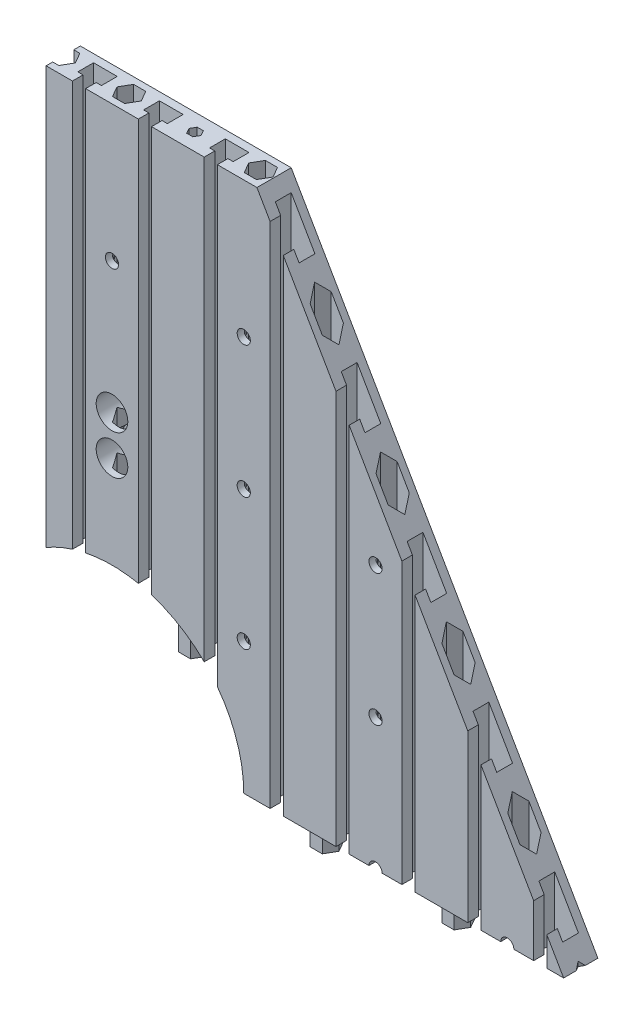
SolidWorks part; units mm, degrees
ref_plane "Plan de face" through (0, 0, 0) normal (0, 0, 1) x (1, 0, 0)
ref_plane "Plan de dessus" through (0, 0, 0) normal (0, 1, 0) x (1, 0, 0)
ref_plane "Plan de droite" through (0, 0, 0) normal (1, 0, 0) x (0, 0, -1)
sketch "Esquisse1" plane through (0, 0, 0) normal (0, 0, 1) x (1, 0, 0)
  line L6 (35.7636, 358.7862) -> (-423.8647, -437.3133) construction
  line L7 (-755.4678, -148.4209) -> (879.7592, -148.4209) construction
  line L8 (-46.1325, 376.7457) -> (415.4529, -422.7436) construction
  line L9 (257.0726, -148.4209) -> (-245.0999, 141.5085) construction
  line L10 (-257.0726, -148.4209) -> (263.2247, 151.9729) construction
  line L11 (-55, 201.5791) -> (55, 201.5791)
  line L12 (-147.0726, -148.4209) -> (147.0726, -148.4209)
  line L13 (147.0726, -148.4209) -> (202.0726, -53.1581)
  line L14 (202.0726, -53.1581) -> (55, 201.5791)
  line L15 (-147.0726, -148.4209) -> (-202.0726, -53.1581)
  line L16 (-202.0726, -53.1581) -> (-55, 201.5791)
  dimension "D1" = 60
  dimension "D2" = 60
  dimension "D3" = 110
  dimension "D4" = 350
  dimension "D5" = 60
  dimension "D6" = 60
  dimension "D7" = 110
  dimension "D8" = 110
extrude "Boss.-Extru.2" add sketch "Esquisse1" along normal blind 13
sketch "Esquisse3" plane through (0, 201.5791, 0) normal (0, 1, 0) x (1, 0, 0)
  line L0 (-12.5, 6.793) -> (-12.5, -19.2478) construction
  line L1 (-8, -3) -> (-17, -3)
  line L2 (-17, -3) -> (-17, -9)
  line L3 (-17, -9) -> (-15, -9)
  line L4 (-15, -9) -> (-15, -13)
  line L5 (55, -13) -> (-55, -13) construction
  line L6 (-10, -9) -> (-10, -13)
  line L7 (-8, -9) -> (-10, -9)
  line L8 (-8, -3) -> (-8, -9)
  line L9 (-15, -13) -> (-10, -13)
  point P2 (-12.5, -13)
  point P14 (-12.5, -3)
  dimension "D1" = 12.5
  dimension "D2" = 9
  dimension "D3" = 5
  dimension "D4" = 6
  dimension "D5" = 4
extrude "Enlèv. mat.-Extru.1" cut sketch "Esquisse3" against normal up to next
pattern_linear "Répétition linéaire1" count 8 spacing 25 along (1, 0, 0) of "Enlèv. mat.-Extru.1"
pattern_linear "Répétition linéaire2" count 7 spacing 25 along (-1, 0, 0) of "Enlèv. mat.-Extru.1"
sketch "certcleRotules" plane through (0, 0, 13) normal (0, 0, 1) x (1, 0, 0)
  circle A0 centre (0, 0) radius 157.5
  dimension "D1" = 315
sketch "Esquisse6" plane through (0, 0, 0) normal (0, 1, 0) x (1, 0, 0)
  line L0 (-157.5, -13) -> (157.5, -13) construction
  line L1 (0, 0) -> (-4.5, 0)
  line L2 (0, 0) -> (0, -13)
  line L3 (-2.5, -9) -> (-4.5, -9)
  line L4 (-4.5, 0) -> (-4.5, -9)
  line L7 (0, -13) -> (-2.5, -13)
  line L8 (-2.5, -9) -> (-2.5, -13)
  dimension "D1" = 4.5
  dimension "D2" = 2.5
  dimension "D3" = 4
revolve "Enlèvement de matière-Révolution1" cut sketch "Esquisse6" angle 360 about L2
pattern_linear "Répétition linéaire3" count 4 spacing 50 along (0, 1, 0) count 4 spacing 50 along (1, 0, 0) of "Enlèvement de matière-Révolution1"
pattern_linear "Répétition linéaire5" count 3 spacing 50 along (0, -1, 0) count 4 spacing 50 along (1, 0, 0) of "Enlèvement de matière-Révolution1"
pattern_linear "Répétition linéaire6" count 4 spacing 50 along (0, 1, 0) count 4 spacing 50 along (-1, 0, 0) of "Enlèvement de matière-Révolution1"
pattern_linear "Répétition linéaire7" count 3 spacing 50 along (0, -1, 0) count 4 spacing 50 along (-1, 0, 0) of "Enlèvement de matière-Révolution1"
sketch "Esquisse8" plane through (0, 0, 0) normal (0, 0, -1) x (-1, 0, 0)
  circle A0 centre (0, 100) radius 4.5 construction
  circle A1 centre (0, 100) radius 4.5
extrude "bouchonBarreauHaut" add sketch "Esquisse8" against normal blind 13
sketch "Esquisse7" plane through (0, 0, 0) normal (0, 0, -1) x (-1, 0, 0)
  line L1 (-6.5, 105.15) -> (6.5, 105.15)
  line L2 (-6.5, 105.15) -> (-6.5, 80.15)
  line L3 (-6.5, 80.15) -> (6.5, 80.15)
  line L4 (6.5, 105.15) -> (6.5, 80.15)
  line L5 (0, 7.15) -> (0, -7.15) construction
  dimension "D1" = 25
  dimension "D2" = 80.15
  dimension "D3" = 13
  dimension "D4" = 6.5
extrude "Boss.-Extru.4" add sketch "Esquisse7" along normal blind 5
sketch "4parties" plane through (0, 0, 0) normal (0, 0, 1) x (1, 0, 0)
  line L0 (-25, 201.5791) -> (-25, 43.3013)
  line L1 (-55, 201.5791) -> (55, 201.5791) construction
  line L2 (-50, 0) -> (-171.3817, 0)
  line L3 (-165, 11.0535) -> (-202.0726, -53.1581) construction
  line L4 (50, 0) -> (171.3817, 0)
  line L5 (202.0726, -53.1581) -> (165, 11.0535) construction
  line L6 (0, -50) -> (0, -148.4209)
  line L7 (-10, -148.4209) -> (10, -148.4209) construction
  circle A0 centre (0, 0) radius 50
  dimension "D1" = 100
  dimension "D2" = 10
sketch "Esquisse9" plane through (0, 0, 0) normal (1, 0, 0) x (0, 0, -1)
  line L0 (5, 80.15) -> (0, 80.15) construction
  line L1 (5, 80.15) -> (5, 105.15) construction
  line L3 (5, 85.15) -> (5, 82.5)
  line L4 (5, 82.5) -> (-3, 82.5)
  line L6 (-3, -148.4209) -> (-3, 201.5791) construction
  line L7 (-13, 157.5) -> (-13, -157.5) construction
  line L8 (-3, 79.15) -> (-13, 79.15)
  line L9 (-3, 79.15) -> (-3, 82.5)
  line L10 (5, 85.15) -> (-13, 85.15)
  line L11 (-13, 79.15) -> (-13, 85.15)
  dimension "D1" = 5
  dimension "D2" = 2.65
  dimension "D3" = 6
revolve "Enlèvement de matière-Révolution2" cut sketch "Esquisse9" angle 360 about L10
pattern_linear "Répétition linéaire8" count 2 spacing 15 along (0, 1, 0) of "Enlèvement de matière-Révolution2"
pattern_circular "Répétition circulaire1" count 3 every 120 about axis through (0, 0, 0) along (0, 0, 1) of "Boss.-Extru.4", "Enlèvement de matière-Révolution2", "Répétition linéaire8"
sketch "Esquisse10" plane through (0, 0, 0) normal (1, 0, 0) x (0, 0, -1)
  line L0 (0, 201.5791) -> (0, -53.1581) construction
  line L1 (0, 77.5) -> (5, 77.5)
  line L2 (0, 77.5) -> (0, 72.5)
  line L3 (0, 72.5) -> (5, 72.5)
  line L4 (5, 77.5) -> (5, 72.5)
  line L5 (0, 50) -> (0, -50) construction
  line L6 (0, -72.5) -> (5, -72.5)
  line L7 (0, -72.5) -> (0, -77.5)
  line L8 (0, -77.5) -> (5, -77.5)
  line L9 (5, -72.5) -> (5, -77.5)
  line L10 (5, 80.15) -> (5, 105.15) construction
  line L11 (-9, 50) -> (0, 50) construction
  line L13 (-9, -100) -> (0, -100) construction
  point P16 (2.5, 72.5)
  point P19 (2.5, -72.5)
  dimension "D1" = 22.5
  dimension "D2" = 5
  dimension "D3" = 22.5
  dimension "D4" = 5
extrude "Boss.-Extru.6" add sketch "Esquisse10" along normal mid plane 250
chamfer "Chanfrein1" distance 5 angle 60 4 edges at (125, -75, -5) (-125, -75, -5) (-125, 75, -5) (125, 75, -5)
sketch "Esquisse11" plane through (0, 0, 13) normal (0, 0, 1) x (1, 0, 0)
  line L0 (-10, -148.4209) -> (-10, 201.5791) construction
  line L1 (-10, 23.5) -> (10, 23.5)
  line L2 (-10, 23.5) -> (-10, -23.5)
  line L3 (-10, -23.5) -> (10, -23.5)
  line L4 (10, 23.5) -> (10, -23.5)
  line L5 (10, -148.4209) -> (10, 201.5791) construction
  dimension "D1" = 47
  dimension "D2" = 23.5
extrude "Enlèv. mat.-Extru.2" cut sketch "Esquisse11" against normal blind 8.9
sketch "Esquisse13" plane through (-8, 0, 0) normal (-1, 0, 0) x (0, 0, 1)
  line L1 (4.1, -23.5) -> (11.1, -23.5)
  line L2 (4.1, -23.5) -> (4.1, -40)
  line L3 (4.1, -40) -> (6.1, -40)
  line L4 (11.1, -23.5) -> (11.1, -35)
  arc A0 (6.1, -40) -> (11.1, -35) centre (6.1, -35) ccw
  dimension "D2" = 5
  dimension "D1" = 16.5
  dimension "D3" = 7
extrude "Enlèv. mat.-Extru.3" cut sketch "Esquisse13" against normal up to surface (16 mm away)
sketch "Esquisse14" plane through (0, 0, 4.1) normal (0, 0, 1) x (1, 0, 0)
  line L0 (-8, 23.5) -> (-8, -40) construction
  line L1 (-3, -20) -> (3, -20)
  line L2 (-8, -25) -> (-8, -35)
  line L3 (-3, -40) -> (3, -40)
  line L4 (8, -25) -> (8, -35)
  line L5 (8, -40) -> (8, 23.5) construction
  line L6 (8, -40) -> (-8, -40) construction
  arc A0 (-8, -35) -> (-3, -40) centre (-3, -35) ccw
  arc A1 (3, -40) -> (8, -35) centre (3, -35) ccw
  arc A2 (3, -20) -> (8, -25) centre (3, -25) cw
  arc A3 (-3, -20) -> (-8, -25) centre (-3, -25) ccw
  point P16 (8, -20)
  point P19 (-8, -20)
  dimension "D3" = 5
  dimension "D1" = 20
extrude "Enlèv. mat.-Extru.4" cut sketch "Esquisse14" against normal up to next
mirror "Symétrie1" about plane through (0, 0, 0) normal (0, 1, 0) of "Enlèv. mat.-Extru.4", "Enlèv. mat.-Extru.3"
sketch "Esquisse15" plane through (0, 0, 0) normal (0, 0, -1) x (-1, 0, 0)
  circle A0 centre (-50, 0) radius 4.5 construction
  circle A1 centre (0, -50) radius 4.5 construction
  circle A2 centre (50, 0) radius 4.5 construction
  circle A3 centre (0, 50) radius 4.5 construction
  circle A4 centre (-50, 0) radius 4.5
  circle A5 centre (0, -50) radius 4.5
  circle A6 centre (50, 0) radius 4.5
  circle A7 centre (0, 50) radius 4.5
extrude "boucheTrousCEntre" add sketch "Esquisse15" against normal up to surface (13 mm away)
sketch "Esquisse16" plane through (0, -148.4209, 0) normal (0, -1, 0) x (1, 0, 0)
  line L0 (0, -9.9) -> (0, 9.9) construction
  line L1 (-2.3094, 2.5) -> (2.3094, 2.5)
  line L2 (2.3094, 2.5) -> (4.6188, 6.5)
  line L3 (4.6188, 6.5) -> (2.3094, 10.5)
  line L4 (2.3094, 10.5) -> (-2.3094, 10.5)
  line L5 (-2.3094, 10.5) -> (-4.6188, 6.5)
  line L6 (-4.6188, 6.5) -> (-2.3094, 2.5)
  line L8 (-10, 13) -> (10, 13) construction
  circle A0 centre (0, 6.5) radius 4 construction
  dimension "D1" = 6.5
  dimension "D2" = 8
extrude "Enlèv. mat.-Extru.5" cut sketch "Esquisse16" against normal through all
pattern_linear "Répétition linéaire9" count 8 spacing 25 along (1, 0, 0) of "Enlèv. mat.-Extru.5"
pattern_linear "Répétition linéaire10" count 8 spacing 25 along (-1, 0, 0) of "Enlèv. mat.-Extru.5"
sketch "Esquisse17" plane through (0, 0, 0) normal (0, 0, -1) x (-1, 0, 0)
  line L0 (-50, 0) -> (-171.3817, 0) construction
  line L1 (25, 201.5791) -> (25, 43.3013) construction
  line L2 (-50, 0) -> (-171.3817, 0)
  line L3 (25, 201.5791) -> (25, 43.3013)
  line L4 (55, 201.5791) -> (-55, 201.5791) construction
  line L5 (55, 201.5791) -> (25, 201.5791)
  line L6 (202.0726, -53.1581) -> (55, 201.5791)
  line L7 (55, 201.5791) -> (-55, 201.5791)
  line L8 (-55, 201.5791) -> (-202.0726, -53.1581)
  line L9 (-202.0726, -53.1581) -> (-147.0726, -148.4209)
  line L10 (-147.0726, -148.4209) -> (147.0726, -148.4209)
  line L11 (147.0726, -148.4209) -> (202.0726, -53.1581)
  line L12 (202.0726, -53.1581) -> (55, 201.5791)
  line L14 (-171.3817, 0) -> (-202.0726, -53.1581)
  line L15 (-202.0726, -53.1581) -> (-147.0726, -148.4209)
  line L16 (-147.0726, -148.4209) -> (147.0726, -148.4209)
  line L17 (147.0726, -148.4209) -> (202.0726, -53.1581)
  circle A0 centre (0, 0) radius 50 construction
  arc A1 (25, 43.3013) -> (-50, 0) centre (0, 0) ccw
  dimension "D1" = 0
extrude "Enlèv. mat.-Extru.6" cut sketch "Esquisse17" against normal through all both and the other way through all
sketch "Esquisse18" plane through (0, 0, 0) normal (0, -1, 0) x (1, 0, 0)
  line L0 (70.3812, 6.5) -> (72.6906, 2.5) construction
  line L1 (72.6906, 2.5) -> (77.3094, 2.5) construction
  line L2 (77.3094, 2.5) -> (79.6188, 6.5) construction
  line L3 (79.6188, 6.5) -> (77.3094, 10.5) construction
  line L4 (77.3094, 10.5) -> (72.6906, 10.5) construction
  line L5 (72.6906, 10.5) -> (70.3812, 6.5) construction
  line L6 (70.3812, 6.5) -> (72.6906, 2.5)
  line L7 (72.6906, 2.5) -> (77.3094, 2.5)
  line L8 (77.3094, 2.5) -> (79.6188, 6.5)
  line L9 (79.6188, 6.5) -> (77.3094, 10.5)
  line L10 (77.3094, 10.5) -> (72.6906, 10.5)
  line L11 (72.6906, 10.5) -> (70.3812, 6.5)
  line L13 (76.1547, 4.5) -> (77.3094, 6.5)
  line L14 (77.3094, 6.5) -> (76.1547, 8.5)
  line L15 (76.1547, 8.5) -> (73.8453, 8.5)
  line L16 (73.8453, 8.5) -> (72.6906, 6.5)
  line L17 (72.6906, 6.5) -> (73.8453, 4.5)
  line L18 (73.8453, 4.5) -> (76.1547, 4.5)
  circle A0 centre (75, 6.5) radius 2 construction
  dimension "D3" = 4
  dimension "D1" = 2
  dimension "D2" = 2
extrude "Boss.-Extru.7" add sketch "Esquisse18" along normal mid plane 15
pattern_linear "Répétition linéaire11" count 2 spacing 50 along (1, 0, 0) of "Boss.-Extru.7"
sketch "Esquisse19" plane through (0, 201.5791, 0) normal (0, 1, 0) x (1, 0, 0)
  line L0 (22.6906, -2.5) -> (27.3094, -2.5) construction
  line L1 (27.3094, -6.5) -> (26.1547, -4.5)
  line L2 (26.1547, -4.5) -> (23.8453, -4.5)
  line L3 (23.8453, -4.5) -> (22.6906, -6.5)
  line L4 (22.6906, -6.5) -> (23.8453, -8.5)
  line L5 (23.8453, -8.5) -> (26.1547, -8.5)
  line L6 (26.1547, -8.5) -> (27.3094, -6.5)
  line L7 (27.3094, -2.5) -> (29.6188, -6.5) construction
  line L8 (29.6188, -6.5) -> (27.3094, -10.5) construction
  line L9 (27.3094, -10.5) -> (22.6906, -10.5) construction
  line L10 (22.6906, -10.5) -> (20.3812, -6.5) construction
  line L11 (20.3812, -6.5) -> (22.6906, -2.5) construction
  line L12 (27.3094, -2.5) -> (29.6188, -6.5)
  line L13 (29.6188, -6.5) -> (27.3094, -10.5)
  line L14 (27.3094, -10.5) -> (22.6906, -10.5)
  line L15 (22.6906, -10.5) -> (20.3812, -6.5)
  line L16 (20.3812, -6.5) -> (22.6906, -2.5)
  line L17 (22.6906, -2.5) -> (27.3094, -2.5)
  circle A0 centre (25, -6.5) radius 2 construction
  dimension "D3" = 4
  dimension "D1" = 2
  dimension "D2" = 2
extrude "Boss.-Extru.8" add sketch "Esquisse19" against normal blind 20
pattern_linear "Répétition linéaire12" count 3 spacing 75 along (0, -1, 0) of "Boss.-Extru.8"
